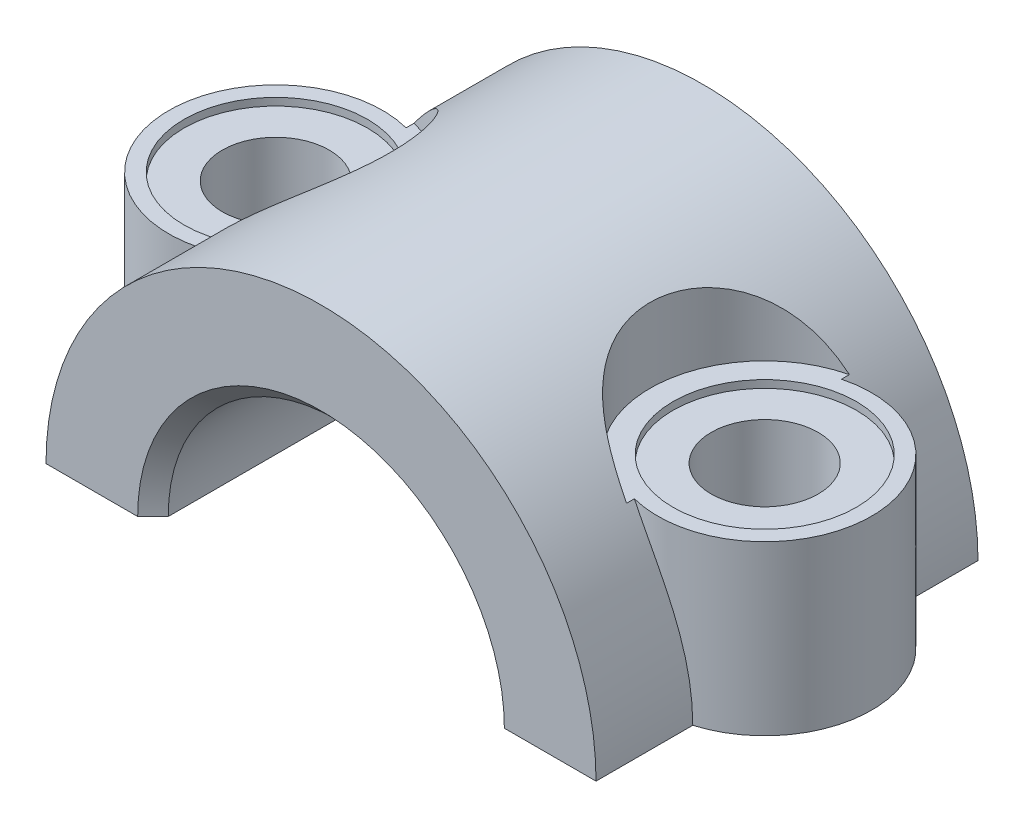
SolidWorks part; units mm, degrees
ref_plane "Front Plane" through (0, 0, 0) normal (0, 0, 1) x (1, 0, 0)
ref_plane "Top Plane" through (0, 0, 0) normal (0, 1, 0) x (1, 0, 0)
ref_plane "Right Plane" through (0, 0, 0) normal (1, 0, 0) x (0, 0, -1)
sketch "Sketch1" plane through (0, 0, 0) normal (0, 0, 1) x (1, 0, 0)
  line L0 (-57.15, 0) -> (57.15, 0)
  arc A0 (57.15, 0) -> (-57.15, 0) centre (0, 0) ccw
  dimension "D1" = 114.3
extrude "Boss-Extrude1" add sketch "Sketch1" along normal blind 79.375
sketch "Sketch3" plane through (0, 0, 0) normal (0, -1, 0) x (1, 0, 0)
  line L0 (0, 0) -> (0, 79.375) construction
  line L1 (-57.15, 0) -> (57.15, 0) construction
  line L2 (-57.15, 79.375) -> (57.15, 79.375) construction
  circle A0 centre (-50.8, 37.973) radius 22.225
  circle A1 centre (50.8, 37.973) radius 22.225
  dimension "D2" = 22.225
  dimension "D1" = 101.6
  dimension "D3" = 41.402
extrude "Boss-Extrude2" add sketch "Sketch3" against normal blind 34.925
sketch "Sketch4" plane through (0, 34.925, 0) normal (0, 1, 0) x (1, 0, 0)
  circle A1 centre (-50.8, -37.973) radius 23.8252
  circle A3 centre (50.8, -37.973) radius 23.8252
  dimension "D1" = 23.8252
extrude "Cut-Extrude1" cut sketch "Sketch4" along normal blind 34.925
hole_wizard "7/8 (0.875) Diameter Hole1" positions "Sketch6" profile "Sketch5" hole size "7/8" standard "ANSI Inch"
sketch "Sketch6" plane through (0, 0, 0) normal (0, -1, 0) x (-1, 0, 0)
  line L0 (0, -79.375) -> (0, 0) construction
  line L1 (57.15, -79.375) -> (-57.15, -79.375) construction
  point P0 (-50.8, -37.973)
  point P2 (50.8, -37.973)
  dimension "D1" = 101.6
  dimension "D2" = 41.402
sketch "Sketch5" plane through (50.8, 0, 37.973) normal (1, 0, 0) x (0, 0, -1)
  line L0 (0, 0) -> (0, 57.15)
  line L1 (0, 57.15) -> (11.1125, 57.15)
  line L2 (11.1125, 57.15) -> (11.1125, 0)
  line L5 (11.1125, 0) -> (0, 0)
  line L11 (0, -6.35) -> (0, 107.95) construction
  dimension "Thru Hole Dia." = 22.225
  dimension "Thru Hole Depth" = 57.15
sketch "Sketch7" plane through (0, 34.925, 0) normal (0, 1, 0) x (1, 0, 0)
  circle A0 centre (-50.8, -37.973) radius 19.05
  circle A1 centre (50.8, -37.973) radius 19.05
  dimension "D1" = 19.05
extrude "Cut-Extrude2" cut sketch "Sketch7" against normal blind 1.5748
sketch "Sketch8" plane through (0, 0, 79.375) normal (0, 0, 1) x (1, 0, 0)
  line L0 (-57.15, 0) -> (57.15, 0) construction
  circle A0 centre (0, 0) radius 34.925
  dimension "D1" = 69.85
extrude "Cut-Extrude3" cut sketch "Sketch8" against normal through all
chamfer "Chamfer1" distance 3.175 angle 45 2 edges at (0, 34.925, 0) (0, 34.925, 79.375)
sketch "Sketch9" [suppressed] plane through (0, 0, 0) normal (0, -1, 0) x (1, 0, 0)
  line L6 (57.15, 0) -> (57.15, 16.6745)
  line L7 (57.15, 59.2715) -> (57.15, 79.375)
  line L8 (57.15, 79.375) -> (-57.15, 79.375)
  line L9 (-57.15, 79.375) -> (-57.15, 59.2715)
  line L10 (-57.15, 16.6745) -> (-57.15, 0)
  line L11 (-57.15, 0) -> (57.15, 0)
  line L12 (57.15, 0) -> (57.15, 16.6745)
  line L13 (57.15, 59.2715) -> (57.15, 79.375)
  line L14 (57.15, 79.375) -> (-57.15, 79.375)
  line L15 (-57.15, 79.375) -> (-57.15, 59.2715)
  line L16 (-57.15, 16.6745) -> (-57.15, 0)
  line L17 (-57.15, 0) -> (57.15, 0)
  arc A2 (57.15, 16.6745) -> (57.15, 59.2715) centre (50.8, 37.973) ccw
  arc A3 (-57.15, 59.2715) -> (-57.15, 16.6745) centre (-50.8, 37.973) ccw
  arc A4 (57.15, 16.6745) -> (57.15, 59.2715) centre (50.8, 37.973) ccw
  arc A5 (-57.15, 59.2715) -> (-57.15, 16.6745) centre (-50.8, 37.973) ccw
  dimension "D1" = 0
extrude "Boss-Extrude3" [suppressed] add sketch "Sketch9" along normal blind 3.175
sketch "Sketch10" [suppressed] plane through (0, 0, 79.375) normal (0, 0, 1) x (1, 0, 0)
  line L3 (-57.15, 0) -> (-57.15, -3.175)
  line L4 (-57.15, -3.175) -> (57.15, -3.175)
  line L5 (57.15, -3.175) -> (57.15, 0)
  line L6 (-57.15, 0) -> (-57.15, -3.175)
  line L7 (-57.15, -3.175) -> (57.15, -3.175)
  line L8 (57.15, -3.175) -> (57.15, 0)
  arc A1 (57.15, 0) -> (-57.15, 0) centre (0, 0) ccw
  arc A2 (57.15, 0) -> (-57.15, 0) centre (0, 0) ccw
  dimension "D1" = 0
extrude "Boss-Extrude4" [suppressed] add sketch "Sketch10" along normal blind 3.175
sketch "Sketch11" [suppressed] plane through (0, 0, 0) normal (0, 0, -1) x (-1, 0, 0)
  line L3 (-57.15, 0) -> (-57.15, -3.175)
  line L4 (-57.15, -3.175) -> (57.15, -3.175)
  line L5 (57.15, -3.175) -> (57.15, 0)
  line L6 (-57.15, 0) -> (-57.15, -3.175)
  line L7 (-57.15, -3.175) -> (57.15, -3.175)
  line L8 (57.15, -3.175) -> (57.15, 0)
  arc A1 (57.15, 0) -> (-57.15, 0) centre (0, 0) ccw
  arc A2 (57.15, 0) -> (-57.15, 0) centre (0, 0) ccw
  dimension "D1" = 0
extrude "Boss-Extrude5" [suppressed] add sketch "Sketch11" along normal blind 3.175
fillet "Fillet2" [suppressed] radius 3.175
